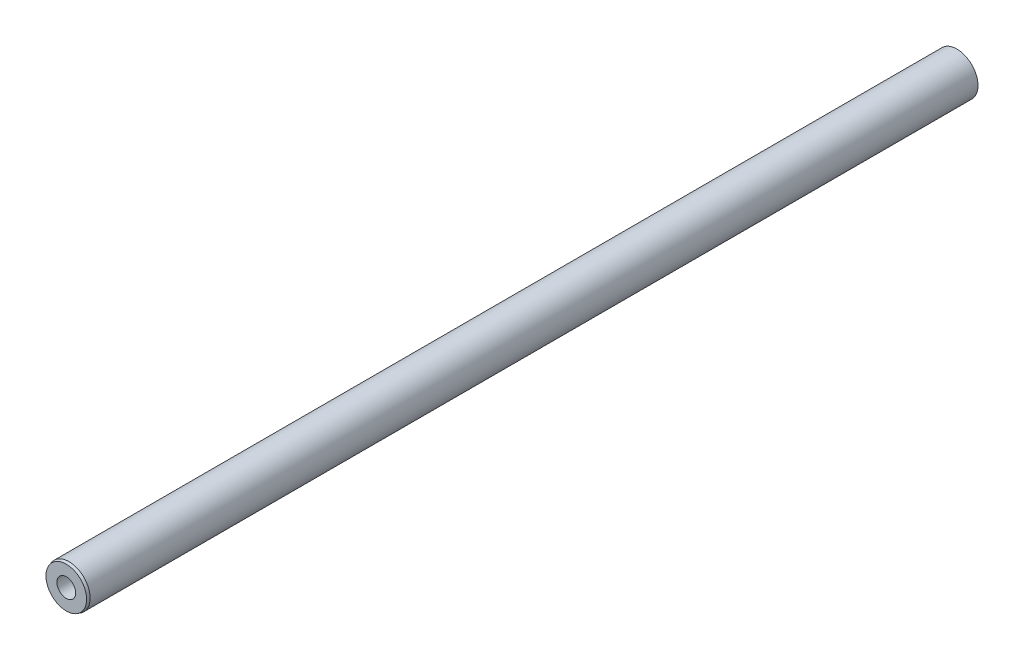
SolidWorks part; units mm, degrees
ref_plane "Front" through (0, 0, 0) normal (0, 0, 1) x (1, 0, 0)
ref_plane "Top" through (0, 0, 0) normal (0, 1, 0) x (1, 0, 0)
ref_plane "Right" through (0, 0, 0) normal (1, 0, 0) x (0, 0, -1)
sketch "Sketch1" plane through (0, 0, 0) normal (0, 0, 1) x (1, 0, 0)
  circle A0 centre (0, 0) radius 9.525
  dimension "D1" = 19.05
extrude "Base-Extrude" add sketch "Sketch1" along normal blind 402.9456
chamfer "Chamfer1" distance 1.27 angle 15 1 edges at (9.525, 0, 402.9456)
hole_wizard "M10x1.5 Tapped Hole1" positions "Sketch3" profile "Sketch2"
sketch "Sketch3" plane through (0, 0, 402.9456) normal (0, 0, 1) x (1, 0, 0)
  point P0 (0, 0)
sketch "Sketch2" plane through (0, 0, 402.9456) normal (1, 0, 0) x (0, -1, 0)
  line L0 (0, 0) -> (0, 22.5537)
  line L1 (0, 22.5537) -> (4.25, 20)
  line L2 (4.25, 20) -> (4.25, 0.0025)
  line L3 (4.25, 0.0025) -> (4.25, 0)
  line L5 (4.25, 0) -> (0, 0)
  line L6 (-4.25, 0.0025) -> (-4.25, 0) construction
  line L10 (0, 22.5537) -> (-4.25, 20) construction
  line L11 (0, -6.35) -> (0, 107.95) construction
